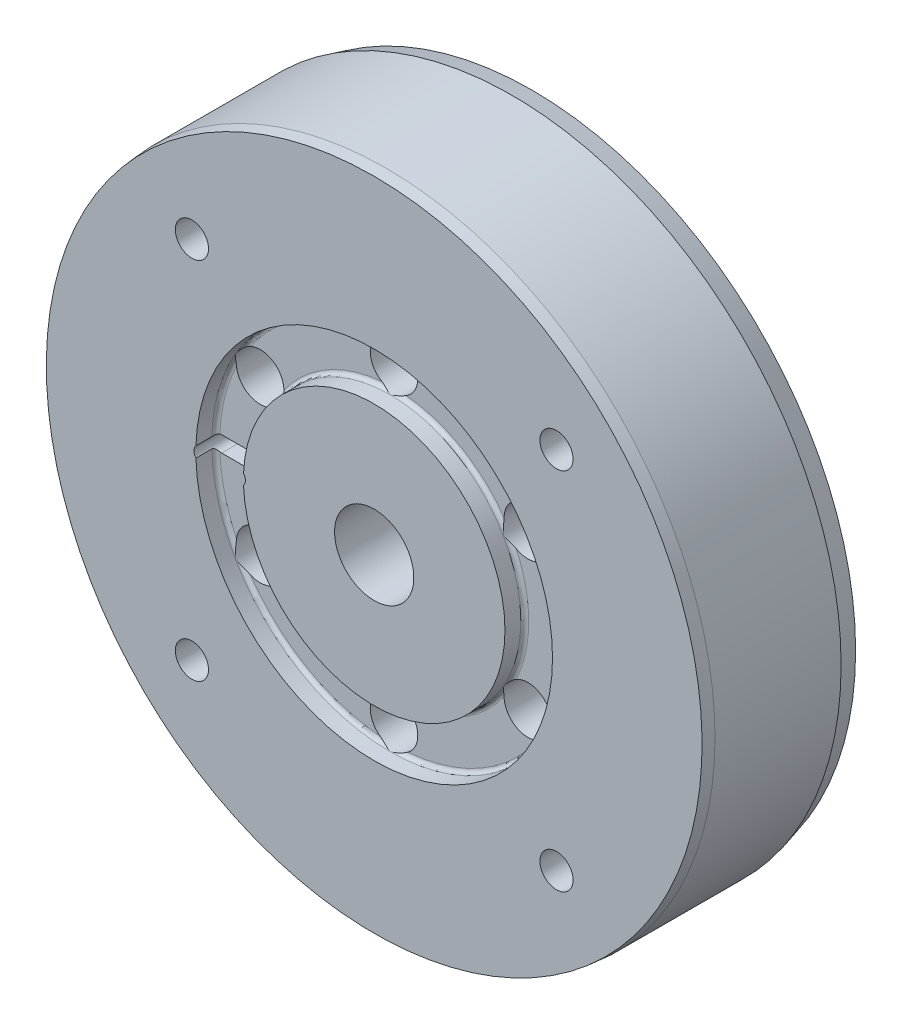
SolidWorks part; units mm, degrees
ref_plane "Plan de face" through (0, 0, 0) normal (0, 0, 1) x (1, 0, 0)
ref_plane "Plan de dessus" through (0, 0, 0) normal (0, 1, 0) x (1, 0, 0)
ref_plane "Plan de droite" through (0, 0, 0) normal (1, 0, 0) x (0, 0, -1)
imported_body "Importée1"
imported_body "Importée2" [suppressed]
ref_plane "Plan1" [suppressed] through (0, 0, 5.01) normal (0, 0, -1) x (-1, 0, 0)
ref_plane "Plan2" through (0, 0, 0.171) normal (0, 0, 1) x (1, 0, 0)
sketch "Esquisse1" plane through (0, 0, 0.171) normal (0, 0, 1) x (1, 0, 0)
  circle A0 centre (0, 0) radius 58
  circle A1 centre (0, 0) radius 86
extrude "Enlèv. mat.-Extru.1" cut sketch "Esquisse1" against normal blind 10
sketch "Esquisse2" plane through (0, 0, 0.171) normal (0, 0, -1) x (-1, 0, 0)
  circle A0 centre (0, 0) radius 83
  circle A1 centre (0, 0) radius 71.105
  dimension "D1" = 142.21
extrude "Extrusion1" add sketch "Esquisse2" along normal blind 5 draft 15
sketch "Esquisse3" plane through (0, 0, 26) normal (0, 0, 1) x (1, 0, 0)
  line L2 (-34.5, 2) -> (-43.2993, 2)
  line L3 (-43.2993, -2) -> (-34.5, -2)
  line L4 (-34.5, 2) -> (-43.5, 2)
  line L5 (-43.5, -2) -> (-34.5, -2)
  arc A0 (-43.5, -2) -> (-43.5, 2) centre (-43.5, 0) cw
  arc A2 (-34.5, -2) -> (-34.5, 2) centre (-34.5, 0) ccw
  arc A3 (-43.2993, 2) -> (-43.2993, -2) centre (-43.2993, 0) ccw
  arc A4 (-34.5, -2) -> (-34.5, 2) centre (-34.5, 0) ccw
  dimension "D1" = 0
extrude "Enlèv. mat.-Extru.2" cut sketch "Esquisse3" along normal blind 10
sketch "Esquisse4" plane through (0, 0, 35) normal (0, 0, 1) x (1, 0, 0)
  line L0 (0, 0) -> (-98.2781, 0)
  line L1 (56.3755, -32.4624) -> (0, 0)
  line L2 (46, -46) -> (69.4931, -69.4931)
  arc A0 (-98.2781, 0) -> (69.4931, -69.4931) centre (0, 0) ccw
  arc A1 (46, -46) -> (56.3755, -32.4624) centre (0, 0) ccw
extrude "Mask" [suppressed] cut sketch "Esquisse4" against normal through all
